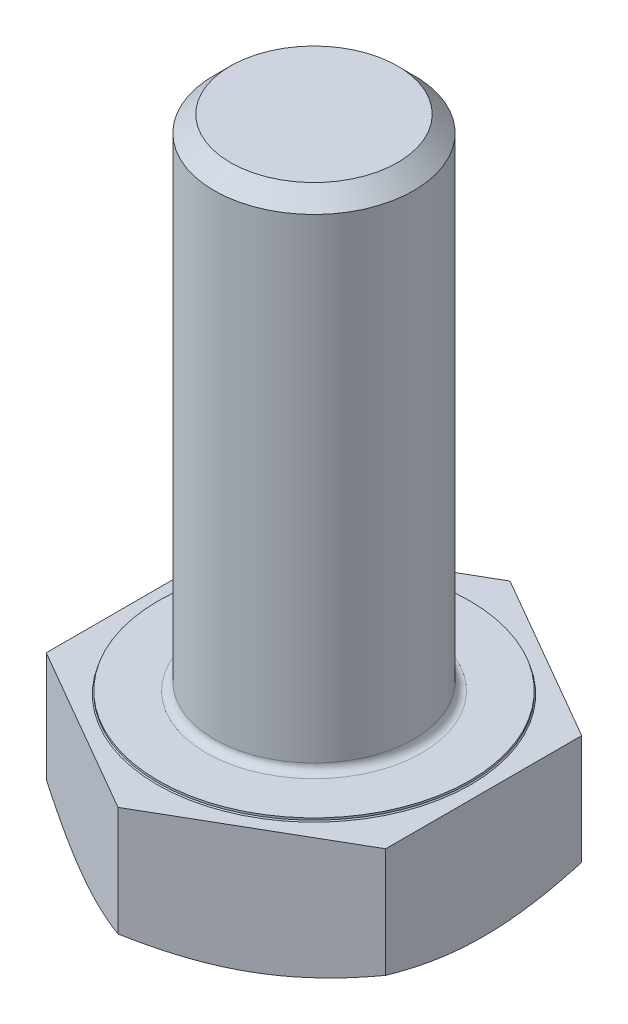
SolidWorks part; units mm, degrees
ref_plane "Plan de face" through (0, 0, 0) normal (0, 0, 1) x (1, 0, 0)
ref_plane "Plan de dessus" through (0, 0, 0) normal (0, 1, 0) x (1, 0, 0)
ref_plane "Plan de droite" through (0, 0, 0) normal (1, 0, 0) x (0, 0, -1)
imported_body "Importée3"
sketch "Esquisse1" plane through (0, -5.6408, 0) normal (0, 1, 0) x (-1, 0, 0)
  line L0 (8.5, 4.9075) -> (8.5, -4.9075)
  line L1 (8.5, -4.9075) -> (0, -9.815)
  line L2 (0, -9.815) -> (-8.5, -4.9075)
  line L3 (-8.5, -4.9075) -> (-8.5, 4.9075)
  line L4 (-8.5, 4.9075) -> (0, 9.815)
  line L5 (0, 9.815) -> (8.5, 4.9075)
extrude "Boss.-Extru.1" add sketch "Esquisse1" along normal blind 5.4908
sketch "Esquisse2" plane through (0, 0, 0) normal (0, 0, 1) x (1, 0, 0)
  line L0 (5, 25) -> (0, 25)
  line L1 (0, 25) -> (0, -0.15)
  line L2 (0, -0.15) -> (7.8, -0.15)
  line L3 (7.8, -0.15) -> (7.8, 0)
  line L4 (7.8, 0) -> (5, 0)
  line L5 (5, 0) -> (5, 25)
  line L6 (0, 25) -> (0, -0.15) construction
revolve "Révolution1" add sketch "Esquisse2" angle 360 about L6
chamfer "Chanfrein1" distance 0.8119 angle 45 1 edges at (0, 25, -5)
chamfer "Chanfrein2" distance 0.05 angle 45 1 edges at (0, -0.15, -7.8)
fillet "Congé1" radius 0.4 1 edges at (0, 0, -5)
